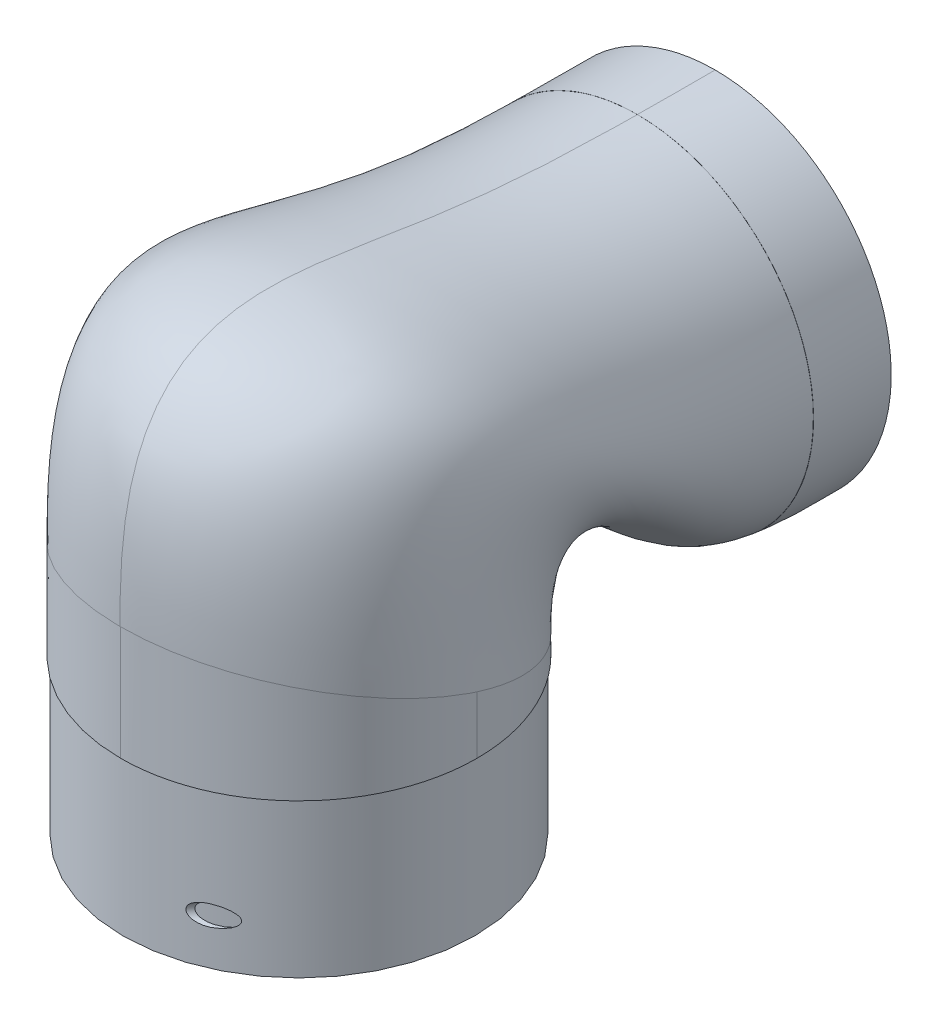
SolidWorks part; units mm, degrees
ref_plane "前视基准面" through (0, 0, 0) normal (0, 0, 1) x (1, 0, 0)
ref_plane "上视基准面" through (0, 0, 0) normal (0, 1, 0) x (1, 0, 0)
ref_plane "右视基准面" through (0, 0, 0) normal (1, 0, 0) x (0, 0, -1)
imported_body "输入1"
sketch "草图1" plane through (0, 0, -76.5519) normal (0, 0, -1) x (-1, 0, 0)
  circle A0 centre (-3.6028, -9.6368) radius 47.5
  circle A1 centre (-3.6028, -9.6368) radius 18.1127
  spline S0 degree 3 number of poles 66 (-3.6031, -57.1368) -> (-3.6032, 37.8632) construction
  spline S1 degree 3 number of poles 66 (-3.6031, -57.1368) -> (-3.6032, 37.8632)
  spline S2 degree 3 number of poles 68 (-3.6032, 37.8632) -> (-3.6031, -57.1368) construction
  spline S3 degree 3 number of poles 68 (-3.6032, 37.8632) -> (-3.6031, -57.1368)
  point P5 (-3.6032, -9.6368)
extrude "凸台-拉伸1" add sketch "草图1" along normal blind 10 contours A1
